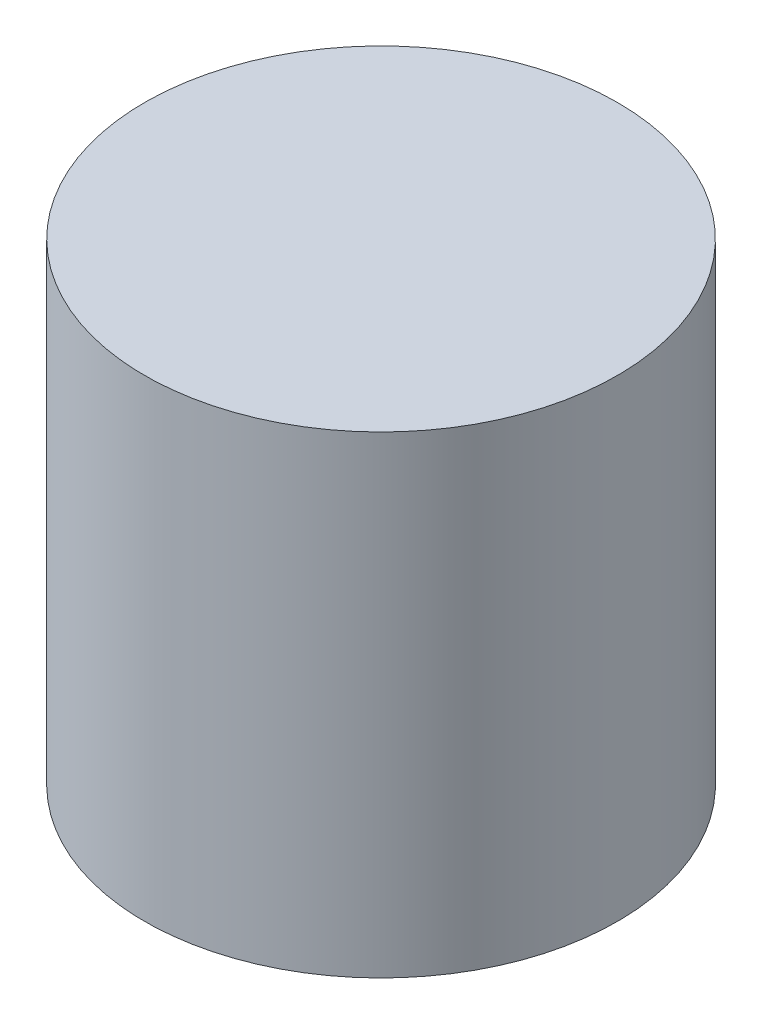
SolidWorks part; units mm, degrees
ref_plane "Plane1" through (0, 0, 0) normal (0, 0, 1) x (1, 0, 0)
ref_plane "Plane2" through (0, 0, 0) normal (0, 1, 0) x (1, 0, 0)
ref_plane "Plane3" through (0, 0, 0) normal (1, 0, 0) x (0, 0, -1)
sketch "Sketch1" plane through (0, 0, 0) normal (0, 0, 1) x (1, 0, 0)
  line L0 (-101.8453, 0) -> (101.8453, 0)
  line L1 (-101.8453, 0) -> (-101.8453, 2)
  line L2 (101.8453, 2) -> (-101.8453, 2)
  line L3 (101.8453, 2) -> (101.8453, 0)
  line L4 (50, 0) -> (-50, 0) construction
  line L5 (0, -25.996) -> (0, 39.4685) construction
  dimension "D1" = 2
extrude "Base-Extrude" add sketch "Sketch1" along normal mid plane 120
sketch "Sketch3" plane through (0, 0, 0) normal (0, -1, 0) x (1, 0, 0)
  circle A0 centre (0, 0) radius 1
  dimension "Diameter" = 2
extrude "Boss-Extrude1" add sketch "Sketch3" along normal blind 2
sketch "Sketch4" plane through (101.8453, 0, 0) normal (1, 0, 0) x (0, 0, -1)
  line L4 (60, 0) -> (60, 2)
  line L5 (60, 2) -> (-60, 2)
  line L6 (-60, 2) -> (-60, 0)
  line L7 (-60, 0) -> (60, 0)
  line L8 (60, 0) -> (60, 2)
  line L9 (60, 2) -> (-60, 2)
  line L10 (-60, 2) -> (-60, 0)
  line L11 (-60, 0) -> (60, 0)
  dimension "D1" = 0
extrude "Cut-Extrude1" cut sketch "Sketch4" against normal through all
sketch "Orientation sketch" plane through (0, 0, 0) normal (0, 1, 0) x (-1, 0, 0)
  circle A1 centre (0, 0) radius 1
  circle A2 centre (0, 0) radius 1
  dimension "D1" = 0
